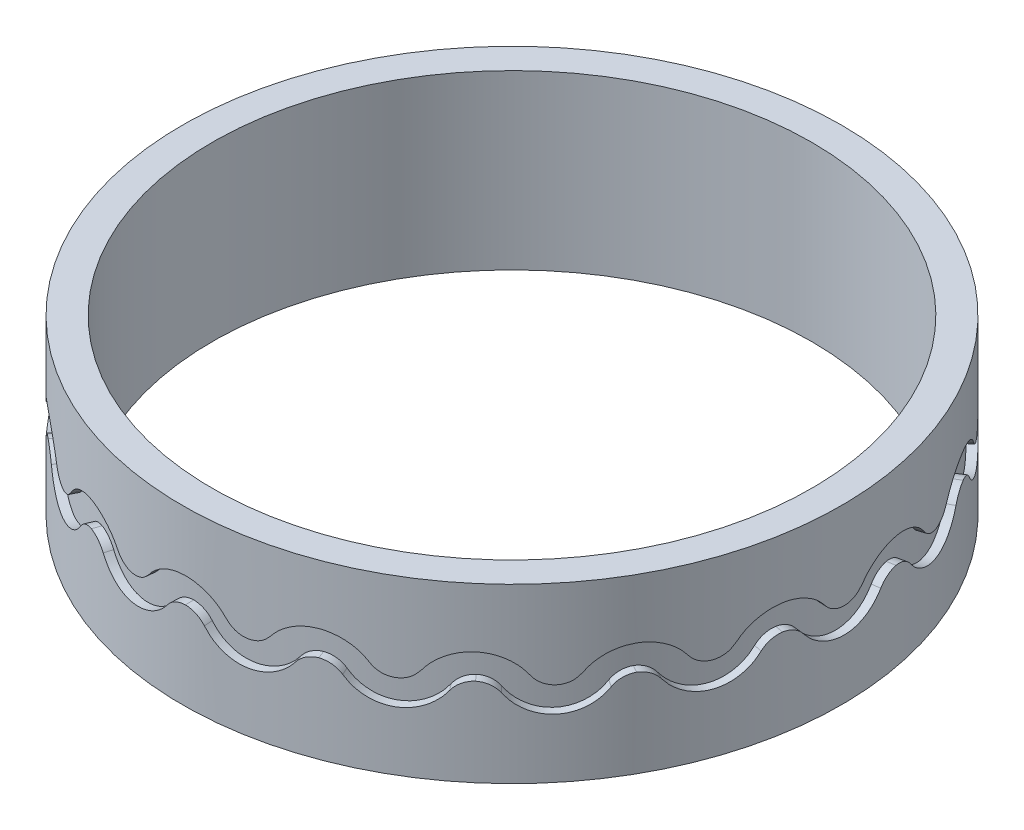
SolidWorks part; units mm, degrees
ref_plane "Vorne" through (0, 0, 0) normal (0, 0, 1) x (1, 0, 0)
ref_plane "Oben" through (0, 0, 0) normal (0, 1, 0) x (1, 0, 0)
ref_plane "Rechts" through (0, 0, 0) normal (1, 0, 0) x (0, 0, -1)
sketch "Skizze1" plane through (0, 0, 0) normal (1, 0, 0) x (0, 0, -1)
  line L0 (0, 0) -> (0, 37.4805) construction
  line L2 (35.4443, 0) -> (38.9672, 0)
  line L3 (35.4443, 0) -> (35.4443, 20.4158)
  line L4 (35.4443, 20.4158) -> (38.9672, 20.4158)
  line L5 (38.9672, 0) -> (38.9672, 20.4158)
revolve "Rotation1" add sketch "Skizze1" angle 21 about L0
ref_plane "Ebene1" through (0, 0, 0) normal (0.9833, 0, -0.1822) x (-0.1822, 0, -0.9833)
ref_plane "Ebene2" through (-7.1012, 10.2079, -38.3147) normal (-0.1822, 0, -0.9833) x (0.9833, 0, -0.1822)
sketch "Skizze4" plane through (-7.1012, 10.2079, -38.3147) normal (-0.1822, 0, -0.9833) x (0.9833, 0, -0.1822)
  line L0 (-6.8629, -0.2094) -> (-6.8629, -3.2094)
  line L3 (6.8629, -0.2094) -> (6.8629, -3.2094)
  line L5 (0, -1.0208) -> (0, 21.4366) construction
  line L9 (-6.4592, -10.2079) -> (-6.4592, 10.2079) construction
  arc A0 (-6.8629, -0.2094) -> (-4.6288, 0.9036) centre (-6.8629, 2.5896) ccw
  arc A1 (-4.6288, 0.9036) -> (4.6288, 0.9036) centre (0, -2.5896) cw
  arc A2 (4.6288, 0.9036) -> (6.8629, -0.2094) centre (6.8629, 2.5896) ccw
  arc A3 (-6.8629, -1.7094) -> (-3.4314, 0) centre (-6.8629, 2.5896) ccw construction
  arc A4 (-3.4314, 0) -> (3.4314, 0) centre (0, -2.5896) cw construction
  arc A5 (3.4314, 0) -> (6.8629, -1.7094) centre (6.8629, 2.5896) ccw construction
  arc A6 (-6.8629, -3.2094) -> (-2.2341, -0.9036) centre (-6.8629, 2.5896) ccw
  arc A7 (-2.2341, -0.9036) -> (2.2341, -0.9036) centre (0, -2.5896) cw
  arc A8 (2.2341, -0.9036) -> (6.8629, -3.2094) centre (6.8629, 2.5896) ccw
  point P22 (0, 3.2094)
  point P38 (-6.4592, 0)
  dimension "D1" = 1.5
  dimension "D2" = 1.5
wrap "Umwickeln3" sketch "Skizze4" wrap type deboss source sketch "Skizze4" thickness 1 parameters "D1"=1
sketch "Skizze5" plane through (0, 0, 0) normal (0, -1, 0) x (1, 0, 0)
  line L0 (-12.376, -33.1011) -> (-13.6466, -36.4995)
  line L1 (-13.6466, -36.4995) -> (-14.9212, -36.023)
  line L2 (-14.9212, -36.023) -> (-13.5154, -32.6292)
  line L3 (-0.3073, -35.2093) -> (-0.34, -38.9657)
  line L4 (-0.34, -38.9657) -> (1.0204, -38.9657)
  line L5 (1.0204, -38.9657) -> (0.922, -35.2093)
  line L6 (-2.0463, -11.0407) -> (2.0463, 11.0407) construction
  line L7 (-12.376, -33.1011) -> (-13.5154, -32.6292)
  line L8 (-0.3073, -35.2093) -> (0.922, -35.2093)
  arc A0 (-13.9646, -36.379) -> (0, -38.9672) centre (0, 0) ccw construction
  dimension "D1" = 10
  dimension "D2" = 10
  dimension "D3" = 2
  dimension "D4" = 2
extrude "Schnitt-Linear austragen5" cut sketch "Skizze5" against normal through all
pattern_circular "Kreismuster9" count 18 over 360 of "Rotation1", "Umwickeln3", "Schnitt-Linear austragen5"
